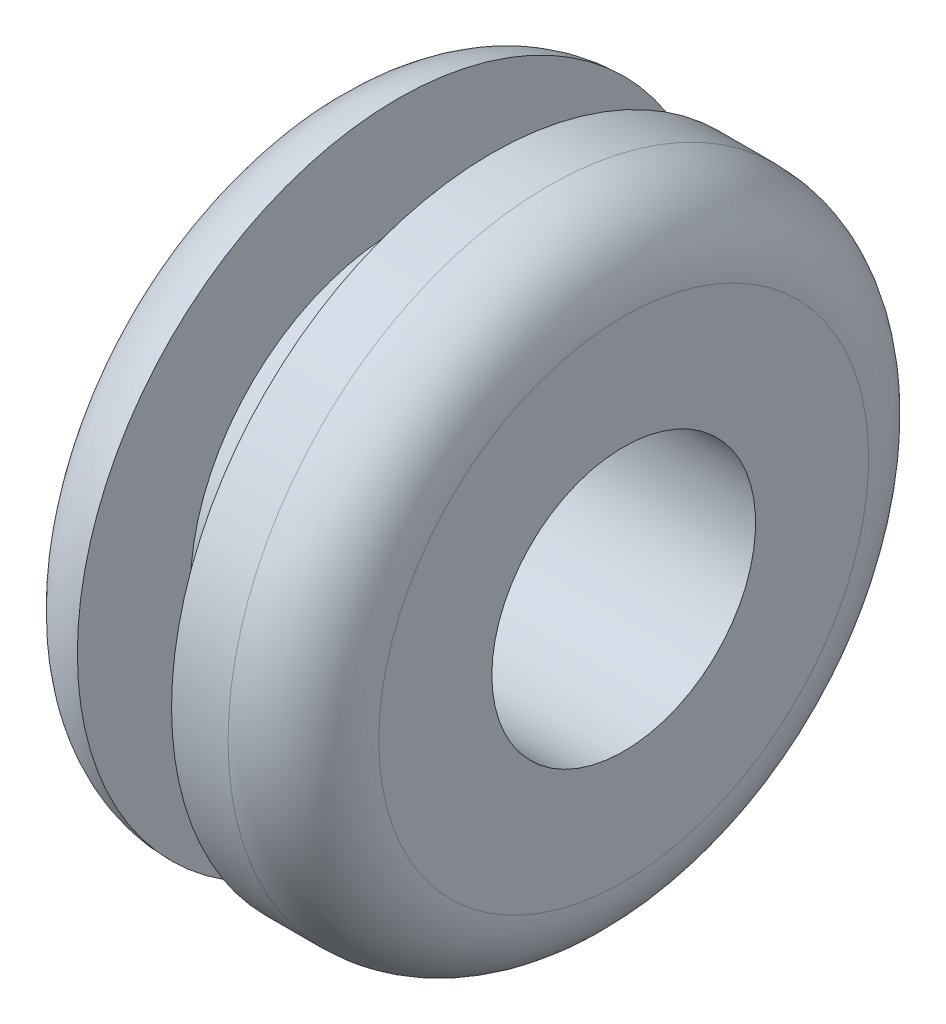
SolidWorks part; units mm, degrees
ref_plane "Plan de face" through (0, 0, 0) normal (0, 0, 1) x (1, 0, 0)
ref_plane "Plan de dessus" through (0, 0, 0) normal (0, 1, 0) x (1, 0, 0)
ref_plane "Plan de droite" through (0, 0, 0) normal (1, 0, 0) x (0, 0, -1)
sketch "Esquisse1" plane through (0, 0, 0) normal (0, 0, 1) x (1, 0, 0)
  line L0 (0, 0) -> (11.5849, 0) construction
  line L1 (0, 3.5) -> (0, 6.5)
  line L2 (2, 8.5) -> (2, 5.5)
  line L3 (2, 5.5) -> (4.5, 5.5)
  line L4 (4.5, 5.5) -> (4.5, 8.5)
  line L5 (4.5, 8.5) -> (6, 8.5)
  line L6 (8, 6.5) -> (8, 3.5)
  line L8 (0, 3.5) -> (8, 3.5)
  arc A0 (0, 6.5) -> (2, 8.5) centre (2, 6.5) cw
  arc A1 (6, 8.5) -> (8, 6.5) centre (6, 6.5) cw
  dimension "D3" = 2
  dimension "D1" = 17
  dimension "D2" = 8
  dimension "D4" = 2.5
  dimension "D5" = 11
  dimension "D6" = 7
revolve "Révolution1" add sketch "Esquisse1" angle 360 about L0
